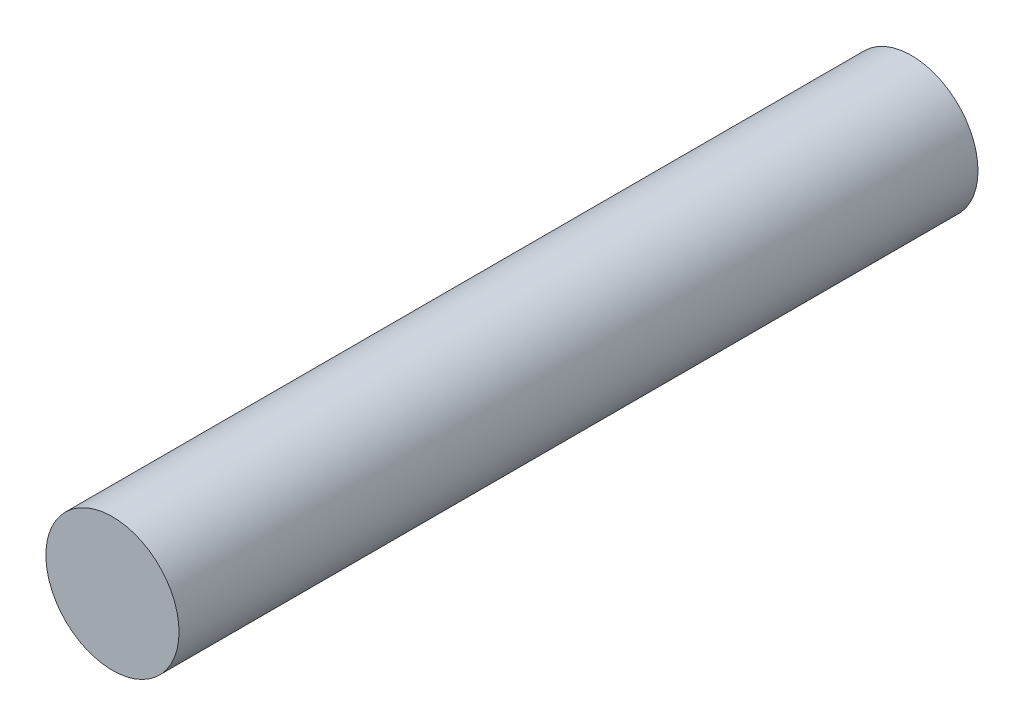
SolidWorks part; units mm, degrees
ref_plane "Plan de face" through (0, 0, 0) normal (0, 0, 1) x (1, 0, 0)
ref_plane "Plan de dessus" through (0, 0, 0) normal (0, 1, 0) x (1, 0, 0)
ref_plane "Plan de droite" through (0, 0, 0) normal (1, 0, 0) x (0, 0, -1)
sketch "Esquisse1" plane through (0, 0, 0) normal (0, 0, 1) x (1, 0, 0)
  circle A0 centre (0, 0) radius 2
extrude "Extrusion1" add sketch "Esquisse1" along normal blind 24
